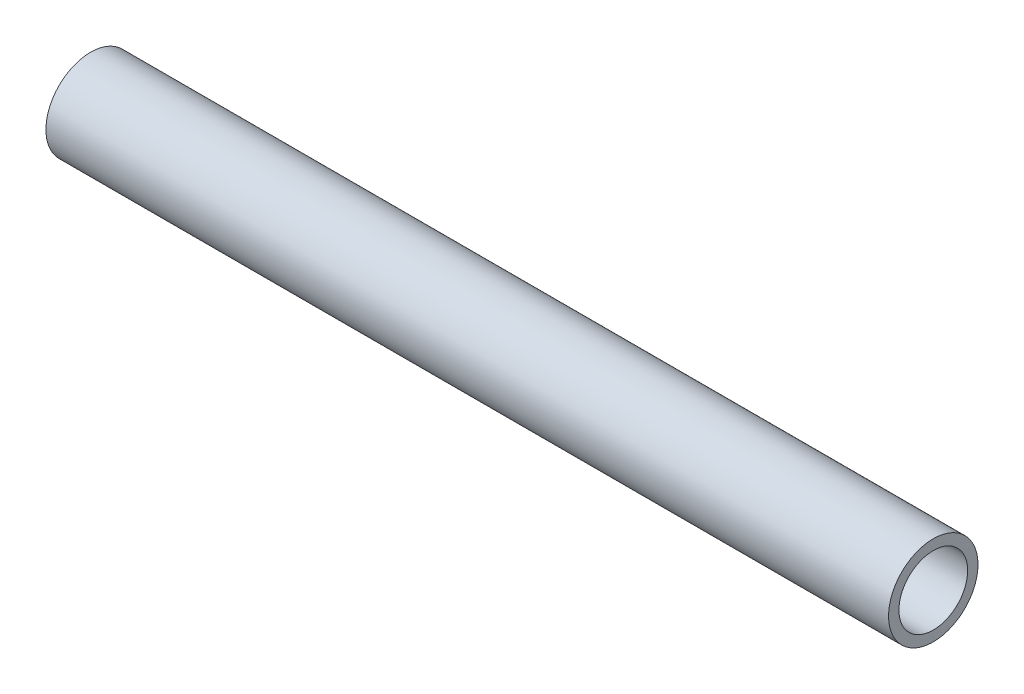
SolidWorks part; units mm, degrees
ref_plane "Front" through (0, 0, 0) normal (0, 0, 1) x (1, 0, 0)
ref_plane "Top" through (0, 0, 0) normal (0, 1, 0) x (1, 0, 0)
ref_plane "Right" through (0, 0, 0) normal (1, 0, 0) x (0, 0, -1)
sketch "Sketch1" plane through (0, 0, 0) normal (0, 0, 1) x (1, 0, 0)
  line L0 (0, 0) -> (311.15, 0)
  line L1 (9.9848, 0) -> (-9.9848, 0) construction
  dimension "D1" = 311.15
other "Structural Member1"
ref_plane "Plane1" through (0, 0, 0) normal (1, 0, 0) x (0, 0, -1)
sketch "Sketch11" plane through (0, 0, 0) normal (1, 0, 0) x (0, 0, -1)
  circle A0 centre (0, 0) radius 12.7
  circle A1 centre (0, 0) radius 16.51
  point P3 (0, 0)
  dimension "D1" = 33.02
  dimension "D2" = 25.4
